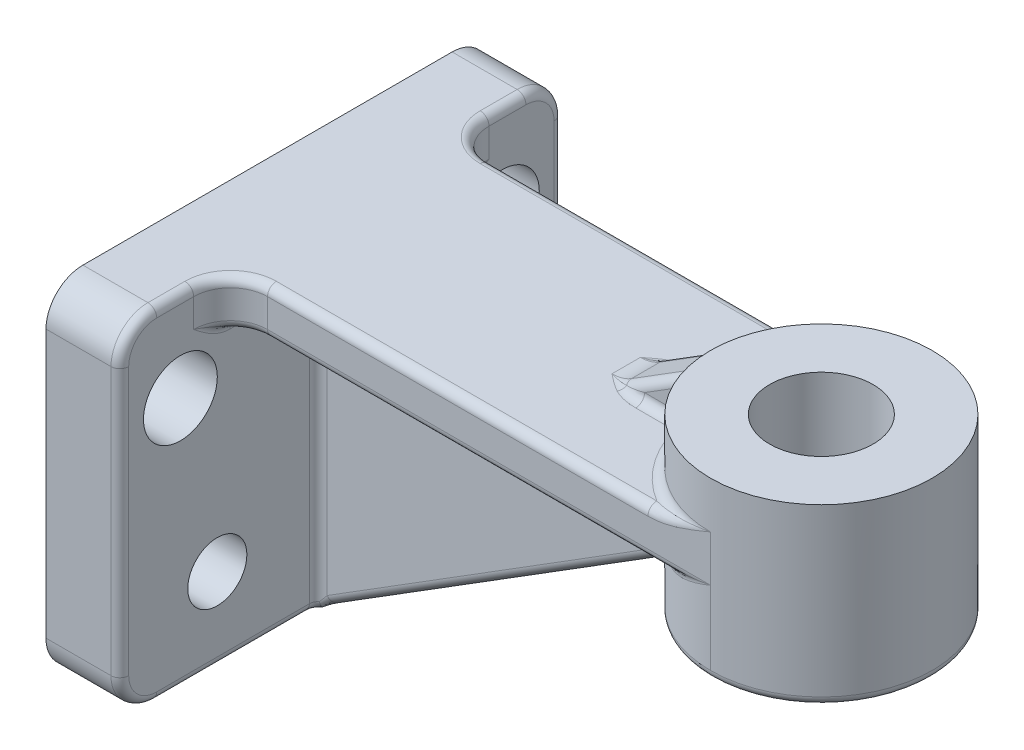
SolidWorks part; units mm, degrees
ref_plane "Front" through (0, 0, 0) normal (0, 0, 1) x (1, 0, 0)
ref_plane "Top" through (0, 0, 0) normal (0, 1, 0) x (1, 0, 0)
ref_plane "Right" through (0, 0, 0) normal (1, 0, 0) x (0, 0, -1)
sketch "Sketch1" plane through (0, 0, 0) normal (1, 0, 0) x (0, 0, -1)
  line L0 (0, 0) -> (76.2, 0)
  line L1 (0, 0) -> (0, 58.7375)
  line L2 (76.2, 58.7375) -> (0, 58.7375)
  line L3 (76.2, 58.7375) -> (76.2, 0)
  dimension "D1" = 76.2
  dimension "D2" = 58.7375
extrude "Base-Extrude" add sketch "Sketch1" along normal blind 12.7
sketch "Sketch2" plane through (12.7, 0, 0) normal (1, 0, 0) x (0, 0, -1)
  line L0 (19.05, 58.7375) -> (57.15, 58.7375)
  line L1 (19.05, 58.7375) -> (19.05, 50.8)
  line L2 (57.15, 50.8) -> (19.05, 50.8)
  line L3 (57.15, 50.8) -> (57.15, 58.7375)
  line L4 (76.2, 58.7375) -> (0, 58.7375) construction
  line L5 (38.1, 58.7375) -> (38.1, 0) construction
  line L6 (0, 0) -> (76.2, 0) construction
  dimension "D1" = 7.9375
  dimension "D2" = 38.1
extrude "Boss-Extrude3" add sketch "Sketch2" along normal offset from surface (82.55 mm away) 95.25
ref_plane "Plane4" through (0, 68.2625, 0) normal (0, 1, 0) x (-1, 0, 0)
sketch "Sketch4" plane through (0, 68.2625, 0) normal (0, 1, 0) x (-1, 0, 0)
  line L0 (-95.25, -57.15) -> (-95.25, -19.05) construction
  circle A0 centre (-95.25, -38.1) radius 19.05
extrude "Boss-Extrude4" add sketch "Sketch4" against normal blind 30.1625
sketch "Sketch7" plane through (0, 0, 0) normal (0, 1, 0) x (1, 0, 0)
  line L0 (12.7, 0) -> (12.7, 76.2) construction
  point P0 (12.7, 38.1)
ref_plane "Plane5" through (0, 0, -38.1) normal (0, 0, 1) x (1, 0, 0)
sketch "Sketch8" plane through (0, 0, -38.1) normal (0, 0, 1) x (1, 0, 0)
  line L0 (12.7, 0) -> (73.66, 38.1)
  line L1 (76.2, 50.8) -> (76.2, 38.1) construction
  line L2 (12.7, 50.8) -> (12.7, 0)
  line L3 (95.25, 50.8) -> (12.7, 50.8) construction
  line L4 (50.8, 50.8) -> (12.7, 50.8)
  line L6 (78.74, 50.8) -> (78.74, 68.2625)
  line L7 (76.2, 50.8) -> (76.2, 38.1) construction
  line L8 (76.2, 50.8) -> (95.25, 50.8) construction
  line L9 (78.74, 50.8) -> (78.74, 38.1)
  line L10 (78.74, 38.1) -> (76.2, 38.1)
  line L11 (73.66, 38.1) -> (76.2, 38.1)
  line L12 (114.3, 68.2625) -> (76.2, 68.2625) construction
  line L13 (78.74, 68.2625) -> (50.8, 50.8)
  point P0 (76.2, 38.1)
  dimension "D1" = 2.54
  dimension "D2" = 2.54
extrude "Boss-Extrude7" add sketch "Sketch8" along normal mid plane 7.9375
fillet "Fillet1" radius 6.35 10 edges at (63.5, 58.7375, -38.1) (73.66, 38.1, -38.1) (6.35, 0, 0) (6.35, 0, -76.2) (6.35, 58.7375, -76.2) (6.35, 58.7375, 0)
fillet "Fillet11" radius 1.524 25 edges at (14.5599, 50.8, -17.1901) (57.15, 50.8, -19.05) (83.2646, 50.8, -23.2928) (44.659, 50.8, -34.1313) (12.7, 50.8, -23.4156) (83.2646, 50.8, -52.9072) (57.15, 50.8, -57.15) (14.5599, 50.8, -59.0099) (12.7, 50.8, -52.7844) (44.659, 50.8, -42.0688) (76.618, 44.45, -42.0688) (76.618, 44.45, -34.1313) (12.7, 25.4, -34.1313) (12.7, 25.4, -42.0688) (83.2646, 58.7375, -52.9072) (83.2646, 58.7375, -23.2928) (76.2, 66.675, -38.1) (76.618, 62.8369, -42.0688) (69.1484, 58.7375, -42.0688) (69.1484, 58.7375, -34.1313) (76.618, 62.8369, -34.1313) (70.8312, 63.3195, -42.0688) (70.8312, 63.3195, -34.1313) (63.4294, 58.9836, -34.1313) (63.4294, 58.9836, -42.0688)
fillet "Fillet12" radius 1.524 27 edges at (14.5599, 58.7375, -17.1901) (12.7, 56.8776, -1.8599) (12.7, 29.3687, 0) (12.7, 1.8599, -1.8599) (12.7, 0, -19.4786) (14.5599, 58.7375, -59.0099) (12.7, 56.8776, -74.3401) (12.7, 29.3687, -76.2) (12.7, 1.8599, -74.3401) (12.7, 0, -56.7214) (13.1464, 0.279, -42.5151) (13.1464, 0.279, -33.6849) (43.1698, 19.0436, -42.0688) (43.1698, 19.0436, -34.1313) (76.3685, 38.1, -42.3977) (114.3, 38.1, -38.1) (76.3685, 38.1, -33.8023) (90.5271, 59.0677, -19.05) (73.7025, 37.8458, -42.0688) (73.7025, 37.8458, -34.1313) (90.5271, 59.0677, -57.15)
other "Hole1"
sketch "Sketch10" plane through (12.7, 0, 0) normal (1, 0, 0) x (0, 0, -1)
  line L1 (1.524, 52.3875) -> (1.524, 6.35) construction
  line L2 (12.7, 57.2135) -> (6.35, 57.2135) construction
  circle A0 centre (10.414, 43.2435) radius 6.35
  dimension "D1" = 13.97
  dimension "D2" = 12.7
  dimension "D3" = 8.89
other "Hole2"
sketch "Sketch11" plane through (12.7, 0, 0) normal (1, 0, 0) x (0, 0, -1)
  line L2 (74.676, 6.35) -> (74.676, 52.3875) construction
  line L3 (69.85, 57.2135) -> (63.5, 57.2135) construction
  circle A0 centre (65.786, 43.2435) radius 6.35
  dimension "D1" = 12.7
  dimension "D2" = 8.89
  dimension "D3" = 13.97
other "Hole3"
sketch "Sketch12" plane through (12.7, 0, 0) normal (1, 0, 0) x (0, 0, -1)
  line L0 (1.524, 52.3875) -> (1.524, 6.35) construction
  line L1 (6.35, 1.524) -> (32.6073, 1.524) construction
  circle A0 centre (16.764, 14.224) radius 5.08
  dimension "D1" = 10.16
  dimension "D2" = 15.24
  dimension "D3" = 12.7
other "Hole4"
sketch "Sketch13" plane through (12.7, 0, 0) normal (1, 0, 0) x (0, 0, -1)
  line L0 (43.5928, 1.524) -> (69.85, 1.524) construction
  line L1 (74.676, 6.35) -> (74.676, 52.3875) construction
  circle A0 centre (61.976, 14.224) radius 5.08
  dimension "D1" = 10.16
  dimension "D2" = 12.7
  dimension "D3" = 12.7
other "Hole5"
sketch "Sketch14" plane through (0, 68.2625, 0) normal (0, 1, 0) x (-1, 0, 0)
  circle A0 centre (-95.25, -38.1) radius 8.89
  circle A3 centre (-95.25, -38.1) radius 19.05 construction
  dimension "D1" = 17.78
